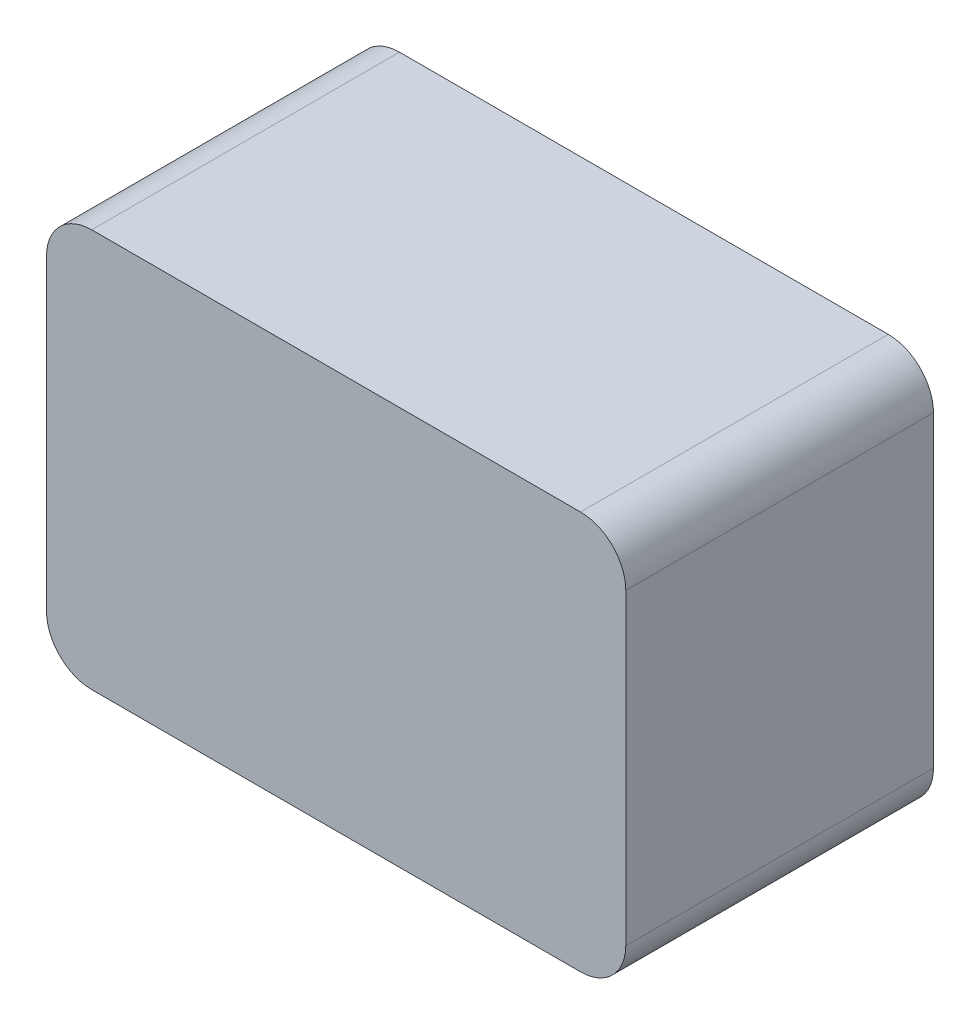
SolidWorks part; units mm, degrees
ref_plane "Спереди" through (0, 0, 0) normal (0, 0, 1) x (1, 0, 0)
ref_plane "Сверху" through (0, 0, 0) normal (0, 1, 0) x (1, 0, 0)
ref_plane "Справа" through (0, 0, 0) normal (1, 0, 0) x (0, 0, -1)
sketch "Эскиз1" plane through (0, 0, 0) normal (0, 0, 1) x (1, 0, 0)
  line L0 (-23.8144, -23.2679) -> (30.1856, -23.2679) construction
  line L1 (35.1856, -18.2679) -> (35.1856, 15.7321) construction
  line L2 (-28.8144, 15.7321) -> (-28.8144, -18.2679) construction
  line L3 (30.1856, 20.7321) -> (-23.8144, 20.7321) construction
  line L4 (-23.8144, -23.2679) -> (30.1856, -23.2679)
  line L5 (35.1856, -18.2679) -> (35.1856, 15.7321)
  line L6 (-28.8144, 15.7321) -> (-28.8144, -18.2679)
  line L7 (30.1856, 20.7321) -> (-23.8144, 20.7321)
  line L32 (-24.0644, 10.7321) -> (-24.0644, -13.2679)
  line L33 (-18.8144, -18.5179) -> (25.1856, -18.5179)
  line L34 (30.4356, -13.2679) -> (30.4356, 10.7321)
  line L35 (25.1856, 15.9821) -> (-18.8144, 15.9821)
  line L36 (-24.0644, 10.7321) -> (-24.0644, -13.2679)
  line L37 (-18.8144, -18.5179) -> (25.1856, -18.5179)
  line L38 (30.4356, -13.2679) -> (30.4356, 10.7321)
  line L39 (25.1856, 15.9821) -> (-18.8144, 15.9821)
  arc A0 (-28.8144, -18.2679) -> (-23.8144, -23.2679) centre (-23.8144, -18.2679) ccw construction
  arc A1 (30.1856, -23.2679) -> (35.1856, -18.2679) centre (30.1856, -18.2679) ccw construction
  arc A2 (35.1856, 15.7321) -> (30.1856, 20.7321) centre (30.1856, 15.7321) ccw construction
  arc A3 (-23.8144, 20.7321) -> (-28.8144, 15.7321) centre (-23.8144, 15.7321) ccw construction
  arc A4 (-28.8144, -18.2679) -> (-23.8144, -23.2679) centre (-23.8144, -18.2679) ccw
  arc A5 (30.1856, -23.2679) -> (35.1856, -18.2679) centre (30.1856, -18.2679) ccw
  arc A6 (35.1856, 15.7321) -> (30.1856, 20.7321) centre (30.1856, 15.7321) ccw
  arc A7 (-23.8144, 20.7321) -> (-28.8144, 15.7321) centre (-23.8144, 15.7321) ccw
  arc A28 (-18.8144, 15.9821) -> (-24.0644, 10.7321) centre (-18.8144, 10.7321) ccw
  arc A29 (-24.0644, -13.2679) -> (-18.8144, -18.5179) centre (-18.8144, -13.2679) ccw
  arc A30 (25.1856, -18.5179) -> (30.4356, -13.2679) centre (25.1856, -13.2679) ccw
  arc A31 (30.4356, 10.7321) -> (25.1856, 15.9821) centre (25.1856, 10.7321) ccw
  arc A32 (-18.8144, 15.9821) -> (-24.0644, 10.7321) centre (-18.8144, 10.7321) ccw
  arc A33 (-24.0644, -13.2679) -> (-18.8144, -18.5179) centre (-18.8144, -13.2679) ccw
  arc A34 (25.1856, -18.5179) -> (30.4356, -13.2679) centre (25.1856, -13.2679) ccw
  arc A35 (30.4356, 10.7321) -> (25.1856, 15.9821) centre (25.1856, 10.7321) ccw
  dimension "D1" = 0.25
extrude "Бобышка-Вытянуть1" add sketch "Эскиз1" along normal blind 32
sketch "Эскиз7" plane through (0, 0, 32) normal (0, 0, 1) x (1, 0, 0)
  line L4 (-23.8144, -23.2679) -> (30.1856, -23.2679)
  line L5 (35.1856, -18.2679) -> (35.1856, 15.7321)
  line L6 (30.1856, 20.7321) -> (-23.8144, 20.7321)
  line L7 (-28.8144, 15.7321) -> (-28.8144, -18.2679)
  line L8 (-23.8144, -23.2679) -> (30.1856, -23.2679)
  line L9 (35.1856, -18.2679) -> (35.1856, 15.7321)
  line L10 (30.1856, 20.7321) -> (-23.8144, 20.7321)
  line L11 (-28.8144, 15.7321) -> (-28.8144, -18.2679)
  arc A4 (-28.8144, -18.2679) -> (-23.8144, -23.2679) centre (-23.8144, -18.2679) ccw
  arc A5 (30.1856, -23.2679) -> (35.1856, -18.2679) centre (30.1856, -18.2679) ccw
  arc A6 (35.1856, 15.7321) -> (30.1856, 20.7321) centre (30.1856, 15.7321) ccw
  arc A7 (-23.8144, 20.7321) -> (-28.8144, 15.7321) centre (-23.8144, 15.7321) ccw
  arc A8 (-28.8144, -18.2679) -> (-23.8144, -23.2679) centre (-23.8144, -18.2679) ccw
  arc A9 (30.1856, -23.2679) -> (35.1856, -18.2679) centre (30.1856, -18.2679) ccw
  arc A10 (35.1856, 15.7321) -> (30.1856, 20.7321) centre (30.1856, 15.7321) ccw
  arc A11 (-23.8144, 20.7321) -> (-28.8144, 15.7321) centre (-23.8144, 15.7321) ccw
  dimension "D1" = 0
extrude "Бобышка-Вытянуть2" add sketch "Эскиз7" along normal blind 2
